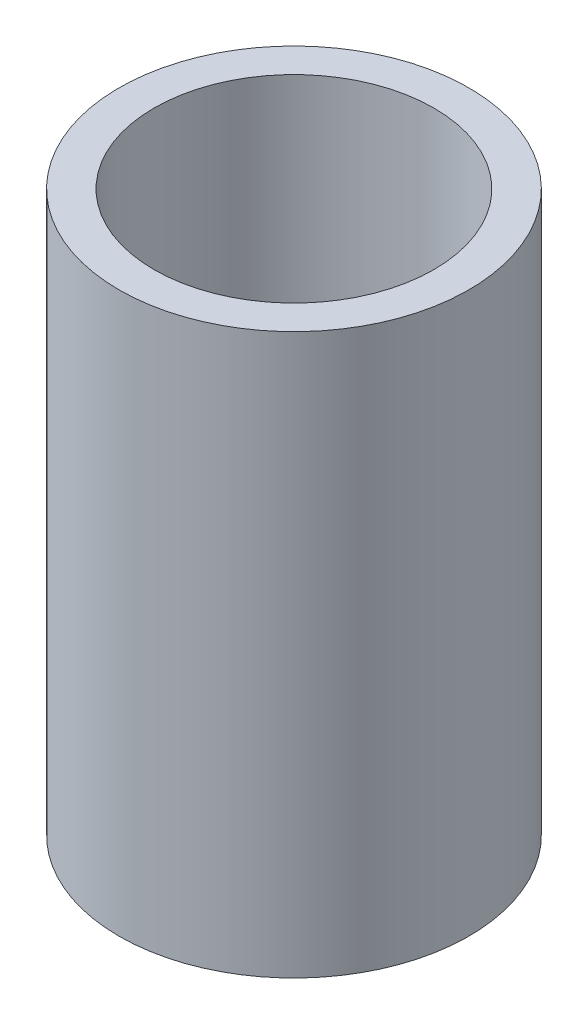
SolidWorks part; units mm, degrees
ref_plane "Front Plane" through (0, 0, 0) normal (0, 0, 1) x (1, 0, 0)
ref_plane "Top Plane" through (0, 0, 0) normal (0, 1, 0) x (1, 0, 0)
ref_plane "Right Plane" through (0, 0, 0) normal (1, 0, 0) x (0, 0, -1)
sketch "Sketch1" plane through (0, 0, 0) normal (0, 1, 0) x (1, 0, 0)
  circle A0 centre (0, 0) radius 7.5
  circle A1 centre (0, 0) radius 6
  dimension "D1" = 15
  dimension "D2" = 12
extrude "Boss-Extrude1" add sketch "Sketch1" along normal mid plane 24
